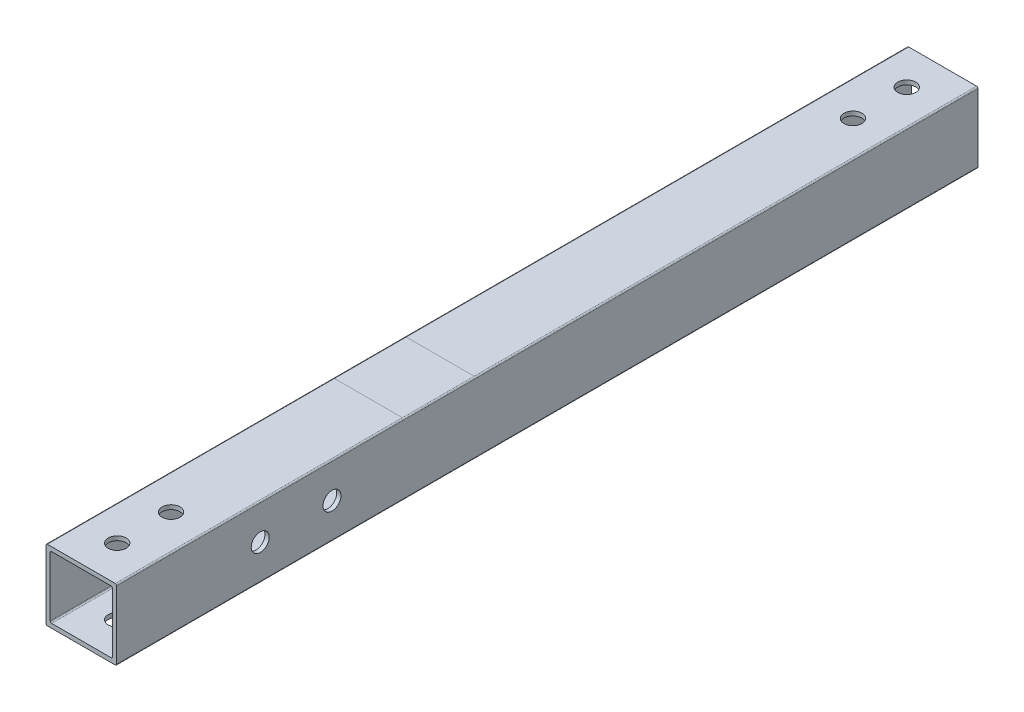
SolidWorks part; units mm, degrees
ref_plane "Front Plane" through (0, 0, 0) normal (0, 0, 1) x (1, 0, 0)
ref_plane "Top Plane" through (0, 0, 0) normal (0, 1, 0) x (1, 0, 0)
ref_plane "Right Plane" through (0, 0, 0) normal (1, 0, 0) x (0, 0, -1)
ref_plane "Plane1" through (0, 0, -2000) normal (0, 0, -1) x (-1, 0, 0)
sketch "Sketch1" plane through (0, 0, -2000) normal (0, 0, -1) x (-1, 0, 0)
  line L0 (11, 10.5) -> (11, -10.5)
  line L1 (10.5, -11) -> (-10.5, -11)
  line L2 (-11, -10.5) -> (-11, 10.5)
  line L3 (-10.5, 11) -> (10.5, 11)
  line L4 (12.5, -12) -> (12.5, 12)
  line L5 (12, 12.5) -> (-12, 12.5)
  line L6 (-12.5, 12) -> (-12.5, -12)
  line L7 (-12, -12.5) -> (12, -12.5)
  line L8 (0, 12.5) -> (0, -12.5) construction
  line L9 (-12.5, 0) -> (12.5, 0) construction
  arc A0 (11, -10.5) -> (10.5, -11) centre (10.5, -10.5) cw
  arc A1 (-10.5, -11) -> (-11, -10.5) centre (-10.5, -10.5) cw
  arc A2 (-11, 10.5) -> (-10.5, 11) centre (-10.5, 10.5) cw
  arc A3 (10.5, 11) -> (11, 10.5) centre (10.5, 10.5) cw
  arc A4 (12.5, 12) -> (12, 12.5) centre (12, 12) ccw
  arc A5 (-12, 12.5) -> (-12.5, 12) centre (-12, 12) ccw
  arc A6 (-12.5, -12) -> (-12, -12.5) centre (-12, -12) ccw
  arc A7 (12, -12.5) -> (12.5, -12) centre (12, -12) ccw
  dimension "D7" = 0.5
  dimension "D8" = 0.5
  dimension "D9" = 0.5
  dimension "D10" = 0.5
  dimension "D11" = 0.5
  dimension "D1" = 25
  dimension "D2" = 25
  dimension "D3" = 1.5
  dimension "D4" = 1.5
  dimension "D5" = 1.5
  dimension "D6" = 1.5
extrude "Boss-Extrude1" add sketch "Sketch1" against normal blind 304.8
sketch "Sketch2" plane through (0, 12.5, 0) normal (0, 1, 0) x (1, 0, 0)
  line L0 (0, 2000) -> (0, 1695.2) construction
  line L1 (-12, 2000) -> (12, 2000) construction
  line L2 (-12, 1695.2) -> (12, 1695.2) construction
  line L3 (-12, 1847.6) -> (12, 1847.6) construction
  line L4 (-12, 1695.2) -> (-12, 2000) construction
  line L5 (12, 1695.2) -> (12, 2000) construction
  circle A0 centre (0, 1987.3) radius 3.175
  circle A1 centre (0, 1968.25) radius 3.175
  circle A2 centre (0, 1707.9) radius 3.175
  circle A3 centre (0, 1726.95) radius 3.175
  dimension "D3" = 6.35
  dimension "D4" = 6.35
  dimension "D1" = 12.7
  dimension "D2" = 31.75
extrude "Cut-Extrude1" cut sketch "Sketch2" against normal up to surface (25 mm away)
sketch "Sketch3" plane through (12.5, 0, 0) normal (1, 0, 0) x (0, 0, -1)
  line L0 (1695.2, 0) -> (2000, 0) construction
  line L1 (1695.2, 12) -> (1695.2, -12) construction
  line L2 (2000, 12) -> (2000, -12) construction
  circle A0 centre (1771.4, 0) radius 3.175
  circle A1 centre (1746, 0) radius 3.175
  dimension "D1" = 6.35
  dimension "D2" = 6.35
  dimension "D3" = 25.4
  dimension "D4" = 50.8
extrude "Cut-Extrude2" cut sketch "Sketch3" against normal up to surface (25 mm away)
sketch "Sketch6" plane through (0, 12.5, 0) normal (0, 1, 0) x (1, 0, 0)
  line L0 (-12, 1796.8) -> (12, 1796.8)
  line L1 (-12, 1695.2) -> (-12, 2000) construction
  line L2 (12, 1695.2) -> (12, 2000) construction
  line L3 (12, 1796.8) -> (12, 1822.2)
  line L4 (12, 1822.2) -> (-12, 1822.2)
  line L5 (-12, 1822.2) -> (-12, 1796.8)
  line L6 (-12, 1695.2) -> (12, 1695.2) construction
  dimension "D1" = 25.4
  dimension "D2" = 101.6
